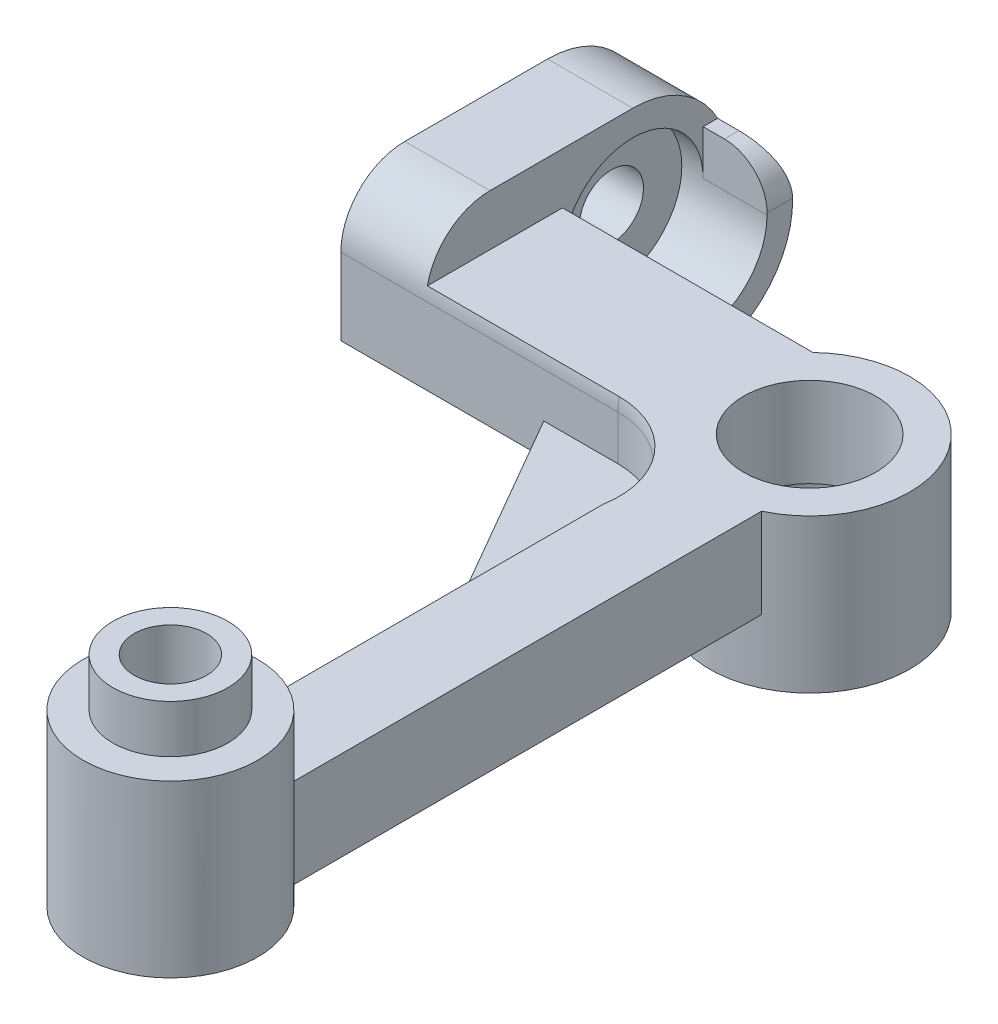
SolidWorks part; units mm, degrees
ref_plane "Plan de face" through (0, 0, 0) normal (0, 0, 1) x (1, 0, 0)
ref_plane "Plan de dessus" through (0, 0, 0) normal (0, 1, 0) x (1, 0, 0)
ref_plane "Plan de droite" through (0, 0, 0) normal (1, 0, 0) x (0, 0, -1)
sketch "Esquisse1" plane through (0, 0, 0) normal (0, 1, 0) x (1, 0, 0)
  line L0 (0, 8.5262) -> (0, -31.6393) construction
  line L1 (11.6614, 0) -> (-26.3902, 0) construction
  line L2 (2, 11.43) -> (2, -33.4795) construction
  line L3 (-2, 11.43) -> (-2, -33.4795) construction
  line L4 (-30.5854, 3.4) -> (4.439, 3.4) construction
  line L5 (-30.5854, -3) -> (4.439, -3) construction
  line L6 (-15, 11.43) -> (-15, -3.6222) construction
  line L7 (11.6614, -30) -> (-4.2601, -30) construction
  line L8 (2, -4.2532) -> (2, -26.4209)
  line L9 (-2, -7) -> (-2, -26.4209)
  line L10 (-6, -3) -> (-15, -3)
  line L11 (-15, -3) -> (-15, 3.4)
  line L12 (-3.245, 3.4) -> (-15, 3.4)
  circle A0 centre (0, 0) radius 3.1
  arc A1 (-2, -7) -> (-6, -3) centre (-6, -7) ccw
  circle A2 centre (0, -30) radius 1.7
  arc A3 (-2, -26.4209) -> (2, -26.4209) centre (0, -30) ccw
  arc A4 (2, -4.2532) -> (-3.245, 3.4) centre (0, 0) ccw
  point P26 (-2, -3)
  dimension "D5" = 13
  dimension "D7" = 4
  dimension "D1" = 2
  dimension "D2" = 4
  dimension "D3" = 3
  dimension "D4" = 6.4
  dimension "D6" = 30
extrude "Boss.-Extru.1" add sketch "Esquisse1" along normal blind 4.2
sketch "Esquisse2" plane through (0, 4.2, 0) normal (0, 1, 0) x (1, 0, 0)
  circle A0 centre (0, -30) radius 1.7
  circle A1 centre (0, -30) radius 4.1
extrude "Boss.-Extru.2" add sketch "Esquisse2" along normal blind 3.8
sketch "Esquisse3" plane through (0, 8, 0) normal (0, 1, 0) x (1, 0, 0)
  circle A0 centre (0, -30) radius 1.7
  circle A1 centre (0, -30) radius 2.7
extrude "Boss.-Extru.3" add sketch "Esquisse3" along normal blind 2.25
sketch "Esquisse7" plane through (0, 0, 0) normal (0, -1, 0) x (1, 0, 0)
  line L0 (10.6811, 0) -> (-18.595, 0) construction
  line L1 (10.6811, 15.95) -> (-6.2293, 15.95) construction
  line L2 (-2, 28.7831) -> (-2, 3) construction
  line L3 (-18.595, 3) -> (-2, 3) construction
  line L4 (-2, 15.95) -> (-16.9534, -9.95) construction
  line L5 (-15, 3) -> (-6, 3) construction
  line L6 (-2, 7) -> (-2, 26.4209) construction
  line L7 (-2, 15.95) -> (-2, 3)
  line L8 (-2, 3) -> (-9.4767, 3)
  line L9 (-9.4767, 3) -> (-2, 15.95)
  dimension "D1" = 30
  dimension "D2" = 15.95
extrude "Boss.-Extru.5" add sketch "Esquisse7" against normal blind 1.5
sketch "Esquisse8" plane through (0, 0, 0) normal (0, -1, 0) x (1, 0, 0)
  circle A0 centre (0, 0) radius 3.2
  circle A1 centre (0, 0) radius 4.7
extrude "Boss.-Extru.6" add sketch "Esquisse8" along normal blind 3
sketch "Esquisse9" plane through (-15, 0, 0) normal (-1, 0, 0) x (0, 0, 1)
  line L0 (0, -5.6109) -> (0, 9.9548) construction
  line L1 (-8.5889, 4.2) -> (2.3589, 4.2) construction
  line L2 (4.2532, 4.2) -> (-4.7, 4.2) construction
  line L3 (-8.5889, 2.1) -> (-1.6475, 2.1) construction
  line L4 (-3.4, -3.7731) -> (-3.4, 5.8476) construction
  line L5 (-2.7201, 0) -> (3, 0)
  line L6 (-3.4, 0) -> (4.7, 0) construction
  line L7 (-6.7, -3.7731) -> (-6.7, 3.1405) construction
  line L8 (3, 0) -> (3, 6.6)
  line L9 (3, 4.2) -> (3, 0) construction
  line L10 (-6.7, 6.6) -> (3, 6.6)
  line L11 (-3.4, 4.2) -> (-3.4, 0) construction
  circle A2 centre (-6.7, 2.1) radius 1.5
  arc A3 (-6.7, 6.6) -> (-2.7201, 0) centre (-6.7, 2.1) ccw
  dimension "D1" = 2.1
  dimension "D2" = 3.3
extrude "Boss.-Extru.7" add sketch "Esquisse9" along normal blind 4
sketch "Esquisse10" plane through (-15, 0, 0) normal (1, 0, 0) x (0, 0, -1)
  circle A0 centre (6.7, 2.1) radius 3.3
extrude "Enlèv. mat.-Extru.1" cut sketch "Esquisse10" against normal blind 1
sketch "Esquisse11" plane through (-15, 0, 0) normal (1, 0, 0) x (0, 0, -1)
  line L0 (7.8823, 5.4) -> (-6.8544, 5.4) construction
  line L1 (10, 2.1) -> (10, 4.2)
  line L2 (3.4, 2.1) -> (3.4, 4.2)
  line L3 (4.7, 4.2) -> (-4.2532, 4.2) construction
  line L5 (3.4, 4.2) -> (2.7201, 4.2)
  line L6 (10, 4.2) -> (10.6799, 4.2)
  arc A0 (3.4, 2.1) -> (10, 2.1) centre (6.7, 2.1) ccw
  arc A1 (2.7201, 4.2) -> (10.6799, 4.2) centre (6.7, 2.1) ccw
extrude "Boss.-Extru.8" add sketch "Esquisse11" along normal blind 3
fillet "Congé2" radius 3 1 edges at (-17, 6.6, 3)
fillet "Congé3" radius 2 1 edges at (-12, 4.2, -10.34)
